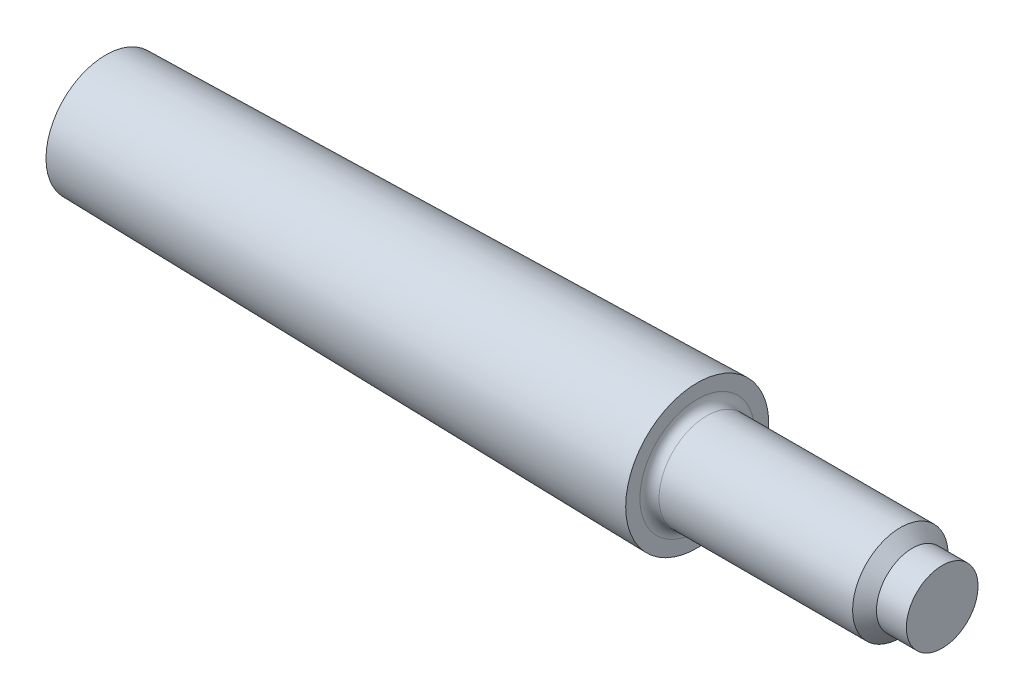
SolidWorks part; units mm, degrees
ref_plane "Front Plane" through (0, 0, 0) normal (0, 0, 1) x (1, 0, 0)
ref_plane "Top Plane" through (0, 0, 0) normal (0, 1, 0) x (1, 0, 0)
ref_plane "Right Plane" through (0, 0, 0) normal (1, 0, 0) x (0, 0, -1)
sketch "BodySke" plane through (0, 0, 0) normal (0, 0, 1) x (1, 0, 0)
  line L0 (0, 0) -> (0, 5) construction
  line L1 (-250, 0) -> (0, 0) construction
  line L2 (0, 5) -> (-250, 0) construction
  line L3 (-99, 0) -> (-99, 10)
  line L4 (-99, 10) -> (0, 11.98)
  line L5 (0, 11.98) -> (0, 8)
  line L6 (0, 8) -> (34, 8)
  line L7 (34, 8) -> (36, 6)
  line L8 (36, 6) -> (41, 6)
  line L9 (41, 6) -> (41, 0)
  line L10 (41, 0) -> (-99, 0)
  line L11 (6, 0) -> (6, 18.5012) construction
  line L12 (39, 0) -> (39, -10.4109) construction
  line L13 (41, 0) -> (76.1668, 0) construction
  point P16 (41, 6.8985)
  dimension "D1" = 5
  dimension "D2" = 250
  dimension "Nominal_dia" = 20
  dimension "Diameter" = 16
  dimension "Dog_chamfer_angle" = 45
  dimension "Thread_length" = 35
  dimension "Distance" = 6
  dimension "Length" = 140
  dimension "Dog_dia" = 12
  dimension "Dog_length" = 5
  dimension "Advance" = 2
  dimension "Thread_minor" = 13.797
revolve "BaseBody" add sketch "BodySke" angle 360 about L1
fillet "Fillet1" radius 1.6 1 edges at (0, 0, 8)
sketch "ThdSchSke" plane through (0, 0, 0) normal (0, 0, 1) x (1, 0, 0)
  line L0 (0, 0) -> (55.9324, 0) construction
  line L2 (32, 9.2719) -> (32, 8)
  line L3 (32, 9.2719) -> (33.2719, 9.2719)
  line L4 (33.2719, 9.2719) -> (33.2719, 8)
  line L5 (33.2719, 8) -> (32.636, 6.8985)
  line L6 (32.636, 6.8985) -> (32, 8)
  line L7 (0, 8) -> (34, 8) construction
  line L8 (34, 8) -> (34, -8) construction
  dimension "D1" = 2
revolve "ThreadSchematic" [suppressed] cut sketch "ThdSchSke" angle 360 about L0
pattern_linear "ThdSchPat" [suppressed]
equation "\"D1@ThdSchSke\" = \"Advance@BodySke\""
equation "\"Tooth_Num@ThdSchPat\" =  int(  ( \"Thread_length@BodySke\" - \"Dog_length@BodySke\" )  / \"Advance@BodySke\" ) "
equation "\"Advance@ThdSchPat\" = \"Advance@BodySke\""
equation "\"Thread_minor@ThreadCosmetic\" = \"Thread_minor@BodySke\""
equation "\"D1@ThreadCosmetic\" = \"Thread_length@BodySke\" - \"Dog_length@BodySke\""
